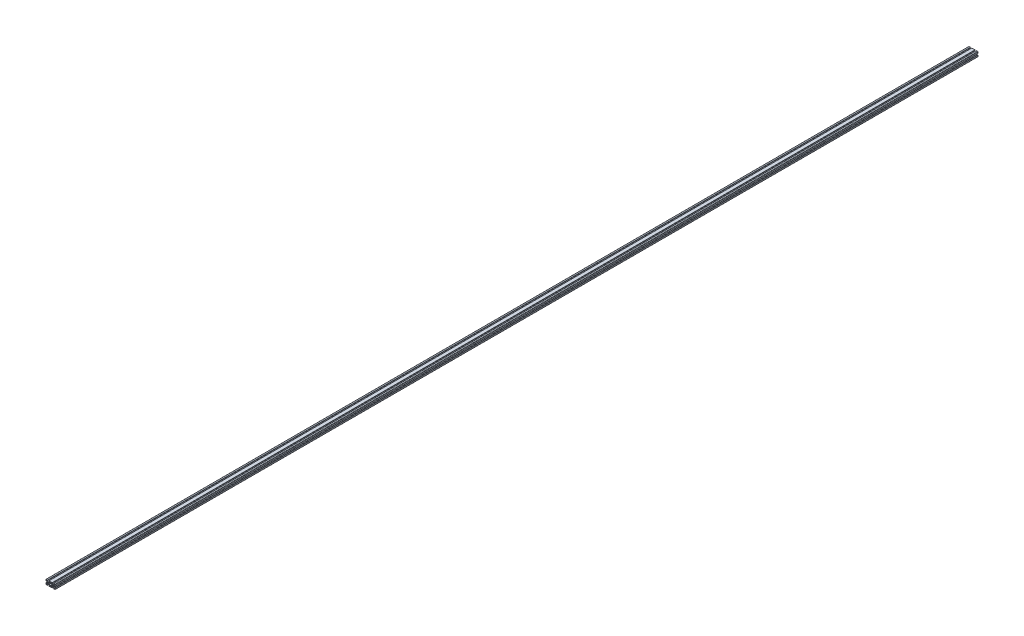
SolidWorks part; units mm, degrees
ref_plane "Front Plane" through (0, 0, 0) normal (0, 0, 1) x (1, 0, 0)
ref_plane "Top Plane" through (0, 0, 0) normal (0, 1, 0) x (1, 0, 0)
ref_plane "Right Plane" through (0, 0, 0) normal (1, 0, 0) x (0, 0, -1)
sketch "Sketch1" plane through (0, 0, 0) normal (0, 0, 1) x (1, 0, 0)
  line L0 (-16.6492, -61.9845) -> (-16.8288, -61.8049)
  line L1 (-16.8288, -57.5551) -> (-16.6492, -57.3755)
  line L2 (-12.3994, -57.3755) -> (-12.2198, -57.5551)
  line L3 (-12.2198, -61.8049) -> (-12.3994, -61.9845)
  line L4 (-27.0293, -67.672) -> (-27.0293, -66.3248)
  line L5 (-27.1781, -65.9655) -> (-30.7205, -62.4231)
  line L6 (-30.8693, -62.0639) -> (-30.8693, -57.2961)
  line L7 (-30.7205, -56.9369) -> (-27.1781, -53.3944)
  line L8 (-27.0293, -53.0352) -> (-27.0293, -51.688)
  line L9 (-26.5213, -51.18) -> (-22.5273, -51.18)
  line L10 (-22.0193, -51.688) -> (-22.0193, -53.0352)
  line L11 (-21.8705, -53.3944) -> (-18.3281, -56.9369)
  line L12 (-18.1793, -57.2961) -> (-18.1793, -62.0639)
  line L13 (-18.3281, -62.4231) -> (-21.8705, -65.9655)
  line L14 (-22.0193, -66.3248) -> (-22.0193, -67.672)
  line L15 (-22.5273, -68.18) -> (-26.5213, -68.18)
  line L16 (-36.6492, -61.9845) -> (-36.8288, -61.8049)
  line L17 (-36.8288, -57.5551) -> (-36.6492, -57.3755)
  line L18 (-32.3994, -57.3755) -> (-32.2198, -57.5551)
  line L19 (-32.2198, -61.8049) -> (-32.3994, -61.9845)
  line L20 (-36.9082, -63.335) -> (-32.1404, -63.335)
  line L21 (-31.7812, -63.4838) -> (-28.6781, -66.5869)
  line L22 (-28.5293, -66.9461) -> (-28.5293, -67.672)
  line L23 (-29.0373, -68.18) -> (-31.3863, -68.18)
  line L24 (-31.8943, -68.688) -> (-31.8943, -69.172)
  line L25 (-31.3863, -69.68) -> (-17.6623, -69.68)
  line L26 (-17.1543, -69.172) -> (-17.1543, -68.688)
  line L27 (-17.6623, -68.18) -> (-20.0113, -68.18)
  line L28 (-20.5193, -67.672) -> (-20.5193, -66.9461)
  line L29 (-20.3705, -66.5869) -> (-17.2674, -63.4838)
  line L30 (-16.9082, -63.335) -> (-12.1404, -63.335)
  line L31 (-11.7812, -63.4838) -> (-8.6781, -66.5869)
  line L32 (-8.5293, -66.9461) -> (-8.5293, -67.672)
  line L33 (-9.0373, -68.18) -> (-11.3863, -68.18)
  line L34 (-11.8943, -68.688) -> (-11.8943, -69.172)
  line L35 (-11.3863, -69.68) -> (-6.0243, -69.68)
  line L36 (-4.5243, -68.18) -> (-4.5243, -62.818)
  line L37 (-5.0323, -62.31) -> (-5.5163, -62.31)
  line L38 (-6.0243, -62.818) -> (-6.0243, -65.167)
  line L39 (-6.5323, -65.675) -> (-7.2582, -65.675)
  line L40 (-7.6174, -65.5262) -> (-10.7205, -62.4231)
  line L41 (-10.8693, -62.0639) -> (-10.8693, -57.2961)
  line L42 (-10.7205, -56.9369) -> (-7.6174, -53.8338)
  line L43 (-7.2582, -53.685) -> (-6.5323, -53.685)
  line L44 (-6.0243, -54.193) -> (-6.0243, -56.542)
  line L45 (-5.5163, -57.05) -> (-5.0323, -57.05)
  line L46 (-4.5243, -56.542) -> (-4.5243, -51.18)
  line L47 (-6.0243, -49.68) -> (-11.3863, -49.68)
  line L48 (-11.8943, -50.188) -> (-11.8943, -50.672)
  line L49 (-11.3863, -51.18) -> (-9.0373, -51.18)
  line L50 (-8.5293, -51.688) -> (-8.5293, -52.4139)
  line L51 (-8.6781, -52.7731) -> (-11.7812, -55.8762)
  line L52 (-12.1404, -56.025) -> (-16.9082, -56.025)
  line L53 (-17.2674, -55.8762) -> (-20.3705, -52.7731)
  line L54 (-20.5193, -52.4139) -> (-20.5193, -51.688)
  line L55 (-20.0113, -51.18) -> (-17.6623, -51.18)
  line L56 (-17.1543, -50.672) -> (-17.1543, -50.188)
  line L57 (-17.6623, -49.68) -> (-31.3863, -49.68)
  line L58 (-31.8943, -50.188) -> (-31.8943, -50.672)
  line L59 (-31.3863, -51.18) -> (-29.0373, -51.18)
  line L60 (-28.5293, -51.688) -> (-28.5293, -52.4139)
  line L61 (-28.6781, -52.7731) -> (-31.7812, -55.8762)
  line L62 (-32.1404, -56.025) -> (-36.9082, -56.025)
  line L63 (-37.2674, -55.8762) -> (-40.3705, -52.7731)
  line L64 (-40.5193, -52.4139) -> (-40.5193, -51.688)
  line L65 (-40.0113, -51.18) -> (-37.6623, -51.18)
  line L66 (-37.1543, -50.672) -> (-37.1543, -50.188)
  line L67 (-37.6623, -49.68) -> (-43.0243, -49.68)
  line L68 (-44.5243, -51.18) -> (-44.5243, -56.542)
  line L69 (-44.0163, -57.05) -> (-43.5323, -57.05)
  line L70 (-43.0243, -56.542) -> (-43.0243, -54.193)
  line L71 (-42.5163, -53.685) -> (-41.7904, -53.685)
  line L72 (-41.4312, -53.8338) -> (-38.3281, -56.9369)
  line L73 (-38.1793, -57.2961) -> (-38.1793, -62.0639)
  line L74 (-38.3281, -62.4231) -> (-41.4312, -65.5262)
  line L75 (-41.7904, -65.675) -> (-42.5163, -65.675)
  line L76 (-43.0243, -65.167) -> (-43.0243, -62.818)
  line L77 (-43.5323, -62.31) -> (-44.0163, -62.31)
  line L78 (-44.5243, -62.818) -> (-44.5243, -68.18)
  line L79 (-43.0243, -69.68) -> (-37.6623, -69.68)
  line L80 (-37.1543, -69.172) -> (-37.1543, -68.688)
  line L81 (-37.6623, -68.18) -> (-40.0113, -68.18)
  line L82 (-40.5193, -67.672) -> (-40.5193, -66.9461)
  line L83 (-40.3705, -66.5869) -> (-37.2674, -63.4838)
  arc A0 (-16.4594, -60.484) -> (-16.8288, -61.8049) centre (-16.2723, -61.2484) ccw
  arc A1 (-16.4594, -58.876) -> (-16.4594, -60.484) centre (-14.5243, -59.68) ccw
  arc A2 (-16.8288, -57.5551) -> (-16.4594, -58.876) centre (-16.2723, -58.1116) ccw
  arc A3 (-15.3283, -57.7449) -> (-16.6492, -57.3755) centre (-16.0927, -57.932) ccw
  arc A4 (-13.7203, -57.7449) -> (-15.3283, -57.7449) centre (-14.5243, -59.68) ccw
  arc A5 (-12.3994, -57.3755) -> (-13.7203, -57.7449) centre (-12.9559, -57.932) ccw
  arc A6 (-12.5892, -58.876) -> (-12.2198, -57.5551) centre (-12.7763, -58.1116) ccw
  arc A7 (-12.5892, -60.484) -> (-12.5892, -58.876) centre (-14.5243, -59.68) ccw
  arc A8 (-12.2198, -61.8049) -> (-12.5892, -60.484) centre (-12.7763, -61.2484) ccw
  arc A9 (-13.7203, -61.6151) -> (-12.3994, -61.9845) centre (-12.9559, -61.428) ccw
  arc A10 (-15.3283, -61.6151) -> (-13.7203, -61.6151) centre (-14.5243, -59.68) ccw
  arc A11 (-16.6492, -61.9845) -> (-15.3283, -61.6151) centre (-16.0927, -61.428) ccw
  arc A12 (-27.0293, -67.672) -> (-26.5213, -68.18) centre (-26.5213, -67.672) ccw
  arc A13 (-27.0293, -66.3248) -> (-27.1781, -65.9655) centre (-27.5373, -66.3248) ccw
  arc A14 (-30.8693, -62.0639) -> (-30.7205, -62.4231) centre (-30.3613, -62.0639) ccw
  arc A15 (-30.7205, -56.9369) -> (-30.8693, -57.2961) centre (-30.3613, -57.2961) ccw
  arc A16 (-27.1781, -53.3944) -> (-27.0293, -53.0352) centre (-27.5373, -53.0352) ccw
  arc A17 (-26.5213, -51.18) -> (-27.0293, -51.688) centre (-26.5213, -51.688) ccw
  arc A18 (-22.0193, -51.688) -> (-22.5273, -51.18) centre (-22.5273, -51.688) ccw
  arc A19 (-22.0193, -53.0352) -> (-21.8705, -53.3944) centre (-21.5113, -53.0352) ccw
  arc A20 (-18.1793, -57.2961) -> (-18.3281, -56.9369) centre (-18.6873, -57.2961) ccw
  arc A21 (-18.3281, -62.4231) -> (-18.1793, -62.0639) centre (-18.6873, -62.0639) ccw
  arc A22 (-21.8705, -65.9655) -> (-22.0193, -66.3248) centre (-21.5113, -66.3248) ccw
  arc A23 (-22.5273, -68.18) -> (-22.0193, -67.672) centre (-22.5273, -67.672) ccw
  arc A24 (-36.4594, -60.484) -> (-36.8288, -61.8049) centre (-36.2723, -61.2484) ccw
  arc A25 (-36.4594, -58.876) -> (-36.4594, -60.484) centre (-34.5243, -59.68) ccw
  arc A26 (-36.8288, -57.5551) -> (-36.4594, -58.876) centre (-36.2723, -58.1116) ccw
  arc A27 (-35.3283, -57.7449) -> (-36.6492, -57.3755) centre (-36.0927, -57.932) ccw
  arc A28 (-33.7203, -57.7449) -> (-35.3283, -57.7449) centre (-34.5243, -59.68) ccw
  arc A29 (-32.3994, -57.3755) -> (-33.7203, -57.7449) centre (-32.9559, -57.932) ccw
  arc A30 (-32.5892, -58.876) -> (-32.2198, -57.5551) centre (-32.7763, -58.1116) ccw
  arc A31 (-32.5892, -60.484) -> (-32.5892, -58.876) centre (-34.5243, -59.68) ccw
  arc A32 (-32.2198, -61.8049) -> (-32.5892, -60.484) centre (-32.7763, -61.2484) ccw
  arc A33 (-33.7203, -61.6151) -> (-32.3994, -61.9845) centre (-32.9559, -61.428) ccw
  arc A34 (-35.3283, -61.6151) -> (-33.7203, -61.6151) centre (-34.5243, -59.68) ccw
  arc A35 (-36.6492, -61.9845) -> (-35.3283, -61.6151) centre (-36.0927, -61.428) ccw
  arc A36 (-36.9082, -63.335) -> (-37.2674, -63.4838) centre (-36.9082, -63.843) ccw
  arc A37 (-31.7812, -63.4838) -> (-32.1404, -63.335) centre (-32.1404, -63.843) ccw
  arc A38 (-28.5293, -66.9461) -> (-28.6781, -66.5869) centre (-29.0373, -66.9461) ccw
  arc A39 (-29.0373, -68.18) -> (-28.5293, -67.672) centre (-29.0373, -67.672) ccw
  arc A40 (-31.3863, -68.18) -> (-31.8943, -68.688) centre (-31.3863, -68.688) ccw
  arc A41 (-31.8943, -69.172) -> (-31.3863, -69.68) centre (-31.3863, -69.172) ccw
  arc A42 (-17.6623, -69.68) -> (-17.1543, -69.172) centre (-17.6623, -69.172) ccw
  arc A43 (-17.1543, -68.688) -> (-17.6623, -68.18) centre (-17.6623, -68.688) ccw
  arc A44 (-20.5193, -67.672) -> (-20.0113, -68.18) centre (-20.0113, -67.672) ccw
  arc A45 (-20.3705, -66.5869) -> (-20.5193, -66.9461) centre (-20.0113, -66.9461) ccw
  arc A46 (-16.9082, -63.335) -> (-17.2674, -63.4838) centre (-16.9082, -63.843) ccw
  arc A47 (-11.7812, -63.4838) -> (-12.1404, -63.335) centre (-12.1404, -63.843) ccw
  arc A48 (-8.5293, -66.9461) -> (-8.6781, -66.5869) centre (-9.0373, -66.9461) ccw
  arc A49 (-9.0373, -68.18) -> (-8.5293, -67.672) centre (-9.0373, -67.672) ccw
  arc A50 (-11.3863, -68.18) -> (-11.8943, -68.688) centre (-11.3863, -68.688) ccw
  arc A51 (-11.8943, -69.172) -> (-11.3863, -69.68) centre (-11.3863, -69.172) ccw
  arc A52 (-6.0243, -69.68) -> (-4.5243, -68.18) centre (-6.0243, -68.18) ccw
  arc A53 (-4.5243, -62.818) -> (-5.0323, -62.31) centre (-5.0323, -62.818) ccw
  arc A54 (-5.5163, -62.31) -> (-6.0243, -62.818) centre (-5.5163, -62.818) ccw
  arc A55 (-6.5323, -65.675) -> (-6.0243, -65.167) centre (-6.5323, -65.167) ccw
  arc A56 (-7.6174, -65.5262) -> (-7.2582, -65.675) centre (-7.2582, -65.167) ccw
  arc A57 (-10.8693, -62.0639) -> (-10.7205, -62.4231) centre (-10.3613, -62.0639) ccw
  arc A58 (-10.7205, -56.9369) -> (-10.8693, -57.2961) centre (-10.3613, -57.2961) ccw
  arc A59 (-7.2582, -53.685) -> (-7.6174, -53.8338) centre (-7.2582, -54.193) ccw
  arc A60 (-6.0243, -54.193) -> (-6.5323, -53.685) centre (-6.5323, -54.193) ccw
  arc A61 (-6.0243, -56.542) -> (-5.5163, -57.05) centre (-5.5163, -56.542) ccw
  arc A62 (-5.0323, -57.05) -> (-4.5243, -56.542) centre (-5.0323, -56.542) ccw
  arc A63 (-4.5243, -51.18) -> (-6.0243, -49.68) centre (-6.0243, -51.18) ccw
  arc A64 (-11.3863, -49.68) -> (-11.8943, -50.188) centre (-11.3863, -50.188) ccw
  arc A65 (-11.8943, -50.672) -> (-11.3863, -51.18) centre (-11.3863, -50.672) ccw
  arc A66 (-8.5293, -51.688) -> (-9.0373, -51.18) centre (-9.0373, -51.688) ccw
  arc A67 (-8.6781, -52.7731) -> (-8.5293, -52.4139) centre (-9.0373, -52.4139) ccw
  arc A68 (-12.1404, -56.025) -> (-11.7812, -55.8762) centre (-12.1404, -55.517) ccw
  arc A69 (-17.2674, -55.8762) -> (-16.9082, -56.025) centre (-16.9082, -55.517) ccw
  arc A70 (-20.5193, -52.4139) -> (-20.3705, -52.7731) centre (-20.0113, -52.4139) ccw
  arc A71 (-20.0113, -51.18) -> (-20.5193, -51.688) centre (-20.0113, -51.688) ccw
  arc A72 (-17.6623, -51.18) -> (-17.1543, -50.672) centre (-17.6623, -50.672) ccw
  arc A73 (-17.1543, -50.188) -> (-17.6623, -49.68) centre (-17.6623, -50.188) ccw
  arc A74 (-31.3863, -49.68) -> (-31.8943, -50.188) centre (-31.3863, -50.188) ccw
  arc A75 (-31.8943, -50.672) -> (-31.3863, -51.18) centre (-31.3863, -50.672) ccw
  arc A76 (-28.5293, -51.688) -> (-29.0373, -51.18) centre (-29.0373, -51.688) ccw
  arc A77 (-28.6781, -52.7731) -> (-28.5293, -52.4139) centre (-29.0373, -52.4139) ccw
  arc A78 (-32.1404, -56.025) -> (-31.7812, -55.8762) centre (-32.1404, -55.517) ccw
  arc A79 (-37.2674, -55.8762) -> (-36.9082, -56.025) centre (-36.9082, -55.517) ccw
  arc A80 (-40.5193, -52.4139) -> (-40.3705, -52.7731) centre (-40.0113, -52.4139) ccw
  arc A81 (-40.0113, -51.18) -> (-40.5193, -51.688) centre (-40.0113, -51.688) ccw
  arc A82 (-37.6623, -51.18) -> (-37.1543, -50.672) centre (-37.6623, -50.672) ccw
  arc A83 (-37.1543, -50.188) -> (-37.6623, -49.68) centre (-37.6623, -50.188) ccw
  arc A84 (-43.0243, -49.68) -> (-44.5243, -51.18) centre (-43.0243, -51.18) ccw
  arc A85 (-44.5243, -56.542) -> (-44.0163, -57.05) centre (-44.0163, -56.542) ccw
  arc A86 (-43.5323, -57.05) -> (-43.0243, -56.542) centre (-43.5323, -56.542) ccw
  arc A87 (-42.5163, -53.685) -> (-43.0243, -54.193) centre (-42.5163, -54.193) ccw
  arc A88 (-41.4312, -53.8338) -> (-41.7904, -53.685) centre (-41.7904, -54.193) ccw
  arc A89 (-38.1793, -57.2961) -> (-38.3281, -56.9369) centre (-38.6873, -57.2961) ccw
  arc A90 (-38.3281, -62.4231) -> (-38.1793, -62.0639) centre (-38.6873, -62.0639) ccw
  arc A91 (-41.7904, -65.675) -> (-41.4312, -65.5262) centre (-41.7904, -65.167) ccw
  arc A92 (-43.0243, -65.167) -> (-42.5163, -65.675) centre (-42.5163, -65.167) ccw
  arc A93 (-43.0243, -62.818) -> (-43.5323, -62.31) centre (-43.5323, -62.818) ccw
  arc A94 (-44.0163, -62.31) -> (-44.5243, -62.818) centre (-44.0163, -62.818) ccw
  arc A95 (-44.5243, -68.18) -> (-43.0243, -69.68) centre (-43.0243, -68.18) ccw
  arc A96 (-37.6623, -69.68) -> (-37.1543, -69.172) centre (-37.6623, -69.172) ccw
  arc A97 (-37.1543, -68.688) -> (-37.6623, -68.18) centre (-37.6623, -68.688) ccw
  arc A98 (-40.5193, -67.672) -> (-40.0113, -68.18) centre (-40.0113, -67.672) ccw
  arc A99 (-40.3705, -66.5869) -> (-40.5193, -66.9461) centre (-40.0113, -66.9461) ccw
extrude "Extrude1" add sketch "Sketch1" along normal blind 4000
